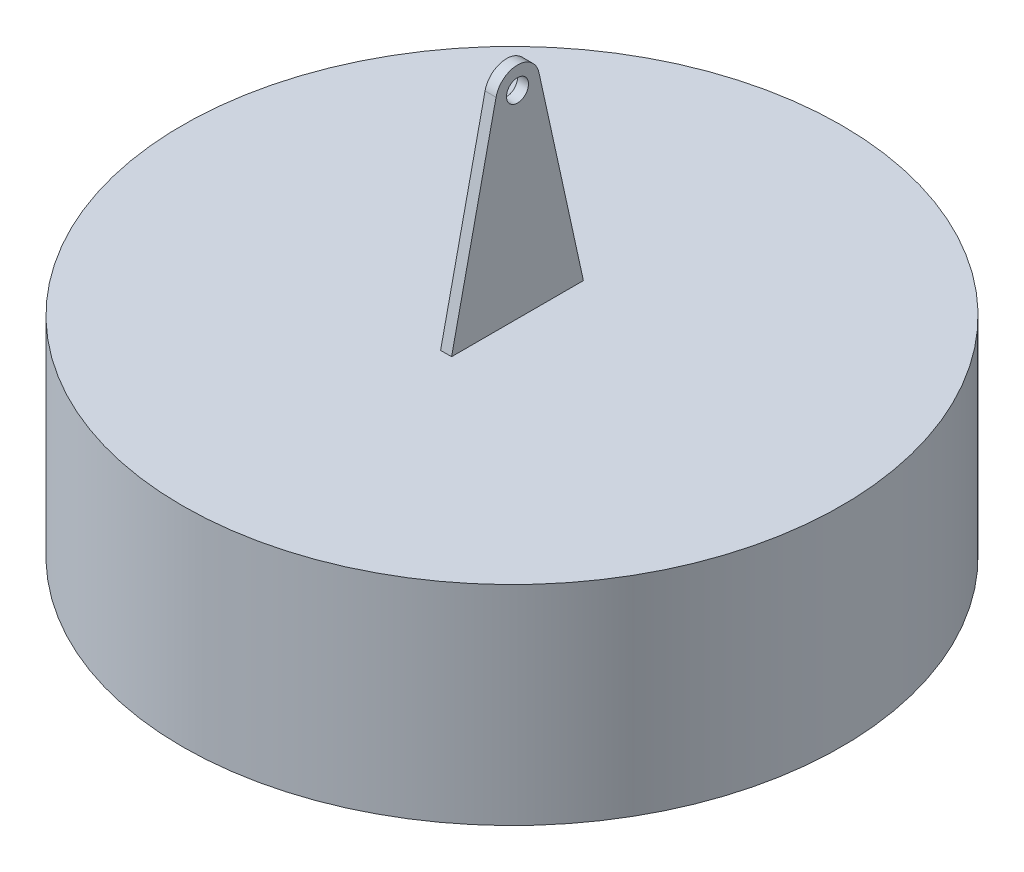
SolidWorks part; units mm, degrees
ref_plane "Front Plane" through (0, 0, 0) normal (0, 0, 1) x (1, 0, 0)
ref_plane "Top Plane" through (0, 0, 0) normal (0, 1, 0) x (1, 0, 0)
ref_plane "Right Plane" through (0, 0, 0) normal (1, 0, 0) x (0, 0, -1)
sketch "Sketch1" plane through (0, 0, 0) normal (0, 1, 0) x (1, 0, 0)
  circle A0 centre (0, 0) radius 762
  dimension "D1" = 1524
extrude "Boss-Extrude1" add sketch "Sketch1" along normal blind 482.6
sketch "Sketch2" plane through (0, 0, 0) normal (1, 0, 0) x (0, 0, -1)
  line L0 (49.618, 950.6949) -> (152.4, 482.6)
  line L1 (762, 482.6) -> (-762, 482.6) construction
  line L2 (152.4, 482.6) -> (-152.4, 482.6)
  line L3 (-152.4, 482.6) -> (-49.618, 950.6949)
  line L4 (0, 939.8) -> (0, 0) construction
  circle A0 centre (0, 939.8) radius 25.4
  arc A1 (49.618, 950.6949) -> (-49.618, 950.6949) centre (0, 939.8) ccw
  circle A2 centre (0, 939.8) radius 50.8 construction
  point P10 (0, 482.6)
  dimension "D1" = 50.8
  dimension "D4" = 457.2
  dimension "D3" = 304.8
  dimension "D2" = 25.4
extrude "Boss-Extrude2" add sketch "Sketch2" along normal mid plane 25.4
